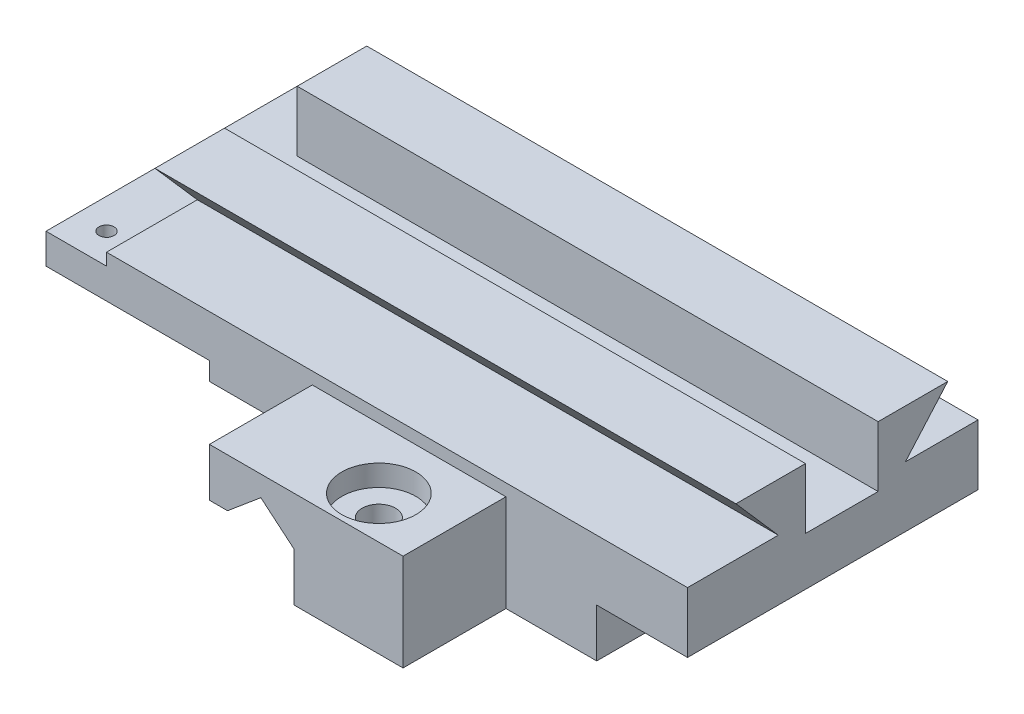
SolidWorks part; units mm, degrees
ref_plane "Piano frontale" through (0, 0, 0) normal (0, 0, 1) x (1, 0, 0)
ref_plane "Piano superiore" through (0, 0, 0) normal (0, 1, 0) x (1, 0, 0)
ref_plane "Piano destro" through (0, 0, 0) normal (1, 0, 0) x (0, 0, -1)
sketch "Schizzo1" plane through (0, 0, 0) normal (0, 0, 1) x (1, 0, 0)
  line L22 (0, 0) -> (27, 0)
  line L23 (27, 0) -> (27, -3)
  line L24 (27, -3) -> (47, -3)
  line L28 (58, -3) -> (58, -11)
  line L29 (58, -11) -> (91, -11)
  line L30 (91, -11) -> (91, -3)
  line L31 (91, -3) -> (106, -3)
  line L32 (106, -3) -> (106, 7)
  line L33 (106, 7) -> (10, 7)
  line L34 (0, 5) -> (0, 0)
  line L35 (0, 5) -> (10, 5)
  line L36 (10, 5) -> (10, 7)
  line L37 (47, -3) -> (52.5, 1.615)
  line L38 (52.5, 1.615) -> (58, -3)
  dimension "D1" = 10
  dimension "D2" = 8
  dimension "D3" = 11
  dimension "D4" = 40
  dimension "D5" = 96
  dimension "D6" = 15
  dimension "D7" = 5
  dimension "D8" = 3
  dimension "D9" = 33
  dimension "D10" = 20
  dimension "D12" = 2
  dimension "D13" = 10
extrude "Estrusione-Estrusione1" add sketch "Schizzo1" along normal blind 65
sketch "Schizzo5" plane through (0, 7, 0) normal (0, 1, 0) x (1, 0, 0)
  line L0 (106, -65) -> (10, -65) construction
  line L1 (44, -65) -> (0, -65)
  line L2 (44, -65) -> (44, -48)
  line L3 (44, -48) -> (0, -48)
  line L4 (0, -65) -> (0, -48)
  line L5 (0, -65) -> (0, 0) construction
  line L6 (106, -65) -> (106, 0) construction
  line L7 (76, -65) -> (106, -65)
  line L8 (76, -65) -> (76, -48)
  line L9 (76, -48) -> (106, -48)
  line L10 (106, -65) -> (106, -48)
  dimension "D1" = 17
  dimension "D2" = 17
  dimension "D3" = 30
  dimension "D4" = 44
extrude "Taglio-Estrusione1" cut sketch "Schizzo5" against normal through all
sketch "Schizzo6" plane through (0, 0, 65) normal (0, 0, 1) x (1, 0, 0)
  line L0 (76, -11) -> (76, 7) construction
  line L1 (44, 7) -> (76, 7)
  line L2 (44, 7) -> (44, 5)
  line L3 (44, 5) -> (76, 5)
  line L4 (76, 7) -> (76, 5)
  dimension "D1" = 2
extrude "Taglio-Estrusione2" cut sketch "Schizzo6" against normal blind 17
hole_wizard "Foro lamato per Bullone M5 a testa esagonale-1" positions "Schizzo7" profile "Schizzo8" counterbore size "M5" standard "ISO"
sketch "Schizzo7" plane through (0, 5, 0) normal (0, 1, 0) x (1, 0, 0)
  line L1 (44, -48) -> (44, -65) construction
  line L2 (44, -65) -> (76, -65) construction
  point P0 (65, -58)
  point P2 (65, -58)
  dimension "D1" = 21
  dimension "D2" = 7
sketch "Schizzo8" plane through (65, 5, 58) normal (1, 0, 0) x (0, 0, 1)
  line L0 (0, 0) -> (0, 16)
  line L1 (0, 16) -> (2.75, 16)
  line L3 (2.75, 16) -> (2.75, 3.5)
  line L4 (2.75, 3.5) -> (6.119, 3.5)
  line L5 (6.119, 3.5) -> (6.119, 0)
  line L7 (6.119, 0) -> (0, 0)
  line L11 (0, -6.35) -> (0, 107.95) construction
  dimension "Thru Hole Dia." = 5.5
  dimension "Thru Hole Depth" = 16
  dimension "C'Bore Dia." = 12.238
  dimension "C'Bore Depth" = 3.5
hole_wizard "Foro filettato M3-2" positions "Schizzo11" profile "Schizzo10" tap size "M3" standard "ISO"
sketch "Schizzo11" plane through (0, 5, 0) normal (0, 1, 0) x (1, 0, 0)
  line L2 (0, -48) -> (0, 0) construction
  line L3 (10, 0) -> (0, 0) construction
  point P0 (5, -5)
  point P2 (5, -43)
  dimension "D1" = 38
  dimension "D2" = 5
  dimension "D3" = 5
sketch "Schizzo10" plane through (5, 5, 5) normal (1, 0, 0) x (0, 0, 1)
  line L0 (0, 0) -> (0, 16)
  line L1 (0, 16) -> (1.25, 16)
  line L2 (1.25, 16) -> (1.25, 0)
  line L5 (1.25, 0) -> (0, 0)
  line L11 (0, -6.35) -> (0, 107.95) construction
  dimension "Thru Tap Drill Dia." = 2.5
  dimension "Thru Tap Drill Depth" = 16
sketch "Schizzo12" plane through (106, 0, 0) normal (1, 0, 0) x (0, 0, -1)
  line L0 (-28.5, 7) -> (-28.5, 15)
  line L1 (-48, 7) -> (0, 7) construction
  line L2 (-28.5, 15) -> (-40, 15)
  line L3 (-40, 15) -> (-33, 7)
  line L4 (-33, 7) -> (-28.5, 7)
  line L5 (-16.5, 7) -> (-16.5, 15)
  line L6 (-16.5, 15) -> (-5, 15)
  line L7 (-5, 15) -> (-12, 7)
  line L8 (-12, 7) -> (-16.5, 7)
extrude "Estrusione-Estrusione3" add sketch "Schizzo12" against normal up to vertex (96 mm away)
sketch "Schizzo13" plane through (106, 0, 0) normal (1, 0, 0) x (0, 0, -1)
  line L1 (-28.5, 7) -> (-16.5, 7)
  line L2 (-28.5, 7) -> (-28.5, 5)
  line L3 (-28.5, 5) -> (-16.5, 5)
  line L4 (-16.5, 7) -> (-16.5, 5)
  dimension "D1" = 2
extrude "Taglio-Estrusione3" cut sketch "Schizzo13" against normal up to next
hole_wizard "Foro filettato M4-1" positions "Schizzo14" profile "Schizzo15" tap size "M4" standard "ISO"
sketch "Schizzo14" plane through (0, -3, 0) normal (0, -1, 0) x (-1, 0, 0)
  line L1 (-44, -48) -> (-27, -48) construction
  line L2 (-27, -48) -> (-27, 0) construction
  point P0 (-34, -19)
  point P2 (-34, -31)
  dimension "D1" = 12
  dimension "D2" = 17
  dimension "D3" = 7
sketch "Schizzo15" plane through (34, -3, 19) normal (1, 0, 0) x (0, 0, -1)
  line L0 (0, 0) -> (0, 6)
  line L1 (0, 6) -> (1.65, 5.0086)
  line L2 (1.65, 5.0086) -> (1.65, 0)
  line L5 (1.65, 0) -> (0, 0)
  line L10 (0, 6) -> (-1.65, 5.0086) construction
  line L11 (0, -6.35) -> (0, 107.95) construction
  dimension "Tap Drill Dia." = 3.3
  dimension "Tap Drill Depth" = 6
  dimension "Drill Angle" = 118
equation "\"D1@Estrusione-Estrusione1\"=48+17"
equation "\"D4@Schizzo12\"=(35-\"D1@Schizzo12\")/2"
